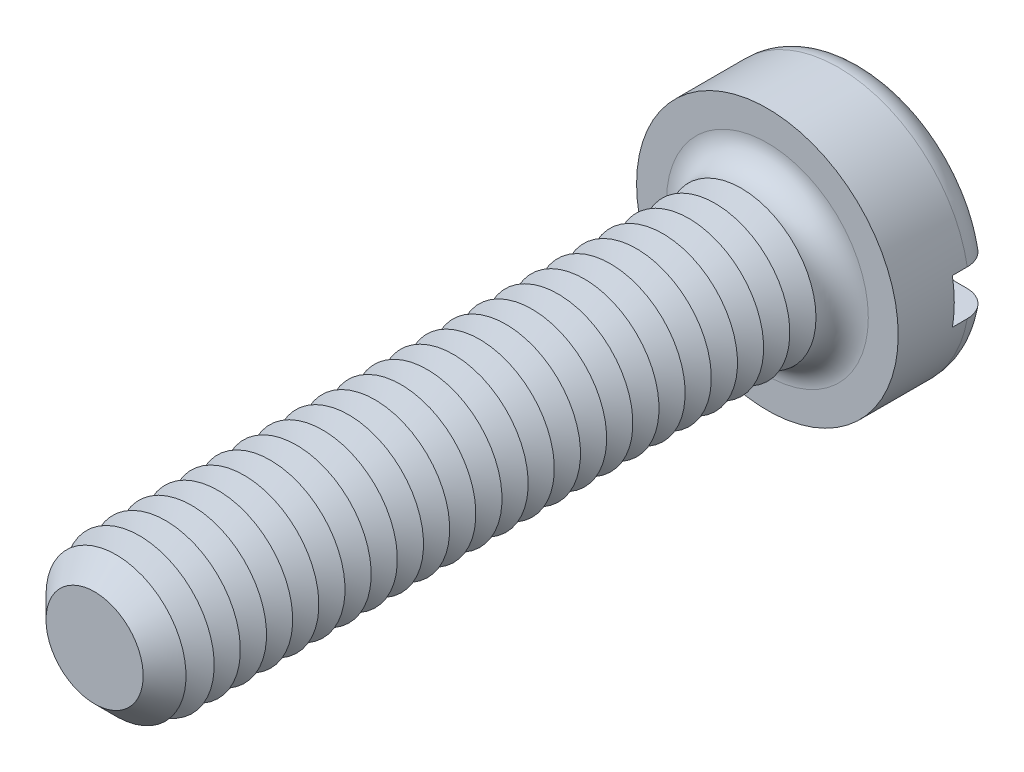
SolidWorks part; units mm, degrees
ref_plane "Front Plane" through (0, 0, 0) normal (0, 0, 1) x (1, 0, 0)
ref_plane "Top Plane" through (0, 0, 0) normal (0, 1, 0) x (1, 0, 0)
ref_plane "Right Plane" through (0, 0, 0) normal (1, 0, 0) x (0, 0, -1)
sketch "Sketch3" plane through (0, 0, 0) normal (0, 0, 1) x (1, 0, 0)
  circle A0 centre (0, 0) radius 3.5
  dimension "D1" = 7
extrude "Boss-Extrude2" add sketch "Sketch3" against normal blind 2.6
sketch "Sketch4" plane through (0, 0, 0) normal (0, 0, 1) x (1, 0, 0)
  circle A0 centre (0, 0) radius 2
  dimension "D1" = 4
extrude "Boss-Extrude3" add sketch "Sketch4" along normal blind 18
fillet "Fillet1" radius 0.7 2 edges at (3.5, 0, -2.6) (2, 0, 0)
chamfer "Chamfer1" distance 0.7 angle 45 1 edges at (2, 0, 18)
sketch "Sketch5" plane through (0, 0, 0) normal (1, 0, 0) x (0, 0, -1)
  line L0 (1.6944, 0) -> (-7.6738, 0) construction
sketch "Sketch6" plane through (0, 0, 0) normal (1, 0, 0) x (0, 0, -1)
  line L0 (-0.7, 2) -> (-1.05, 1.3938)
  line L1 (-1.05, 1.3938) -> (-1.4, 2)
  line L2 (-0.7, 2) -> (-17.3, 2) construction
  line L3 (-1.4, 2) -> (-0.7, 2)
  dimension "D1" = 0.7
revolve "Cut-Revolve1" cut sketch "Sketch6" angle 360 about L0
pattern_linear "LPattern1" count 24 spacing 0.7 along (0, 0, 1) of "Cut-Revolve1"
sketch "Sketch8" plane through (0, 0, -2.6) normal (0, 0, -1) x (-1, 0, 0)
  line L1 (3.5, -0.6) -> (-3.5, -0.6)
  line L2 (3.5, -0.6) -> (3.5, 0.6)
  line L3 (3.5, 0.6) -> (-3.5, 0.6)
  line L4 (-3.5, -0.6) -> (-3.5, 0.6)
  line L5 (3.5, -0.6) -> (-3.5, 0.6) construction
  line L6 (3.5, 0.6) -> (-3.5, -0.6) construction
  point P0 (0, 0)
  dimension "D1" = 7
  dimension "D2" = 1.2
extrude "Cut-Extrude1" cut sketch "Sketch8" against normal blind 1.1
